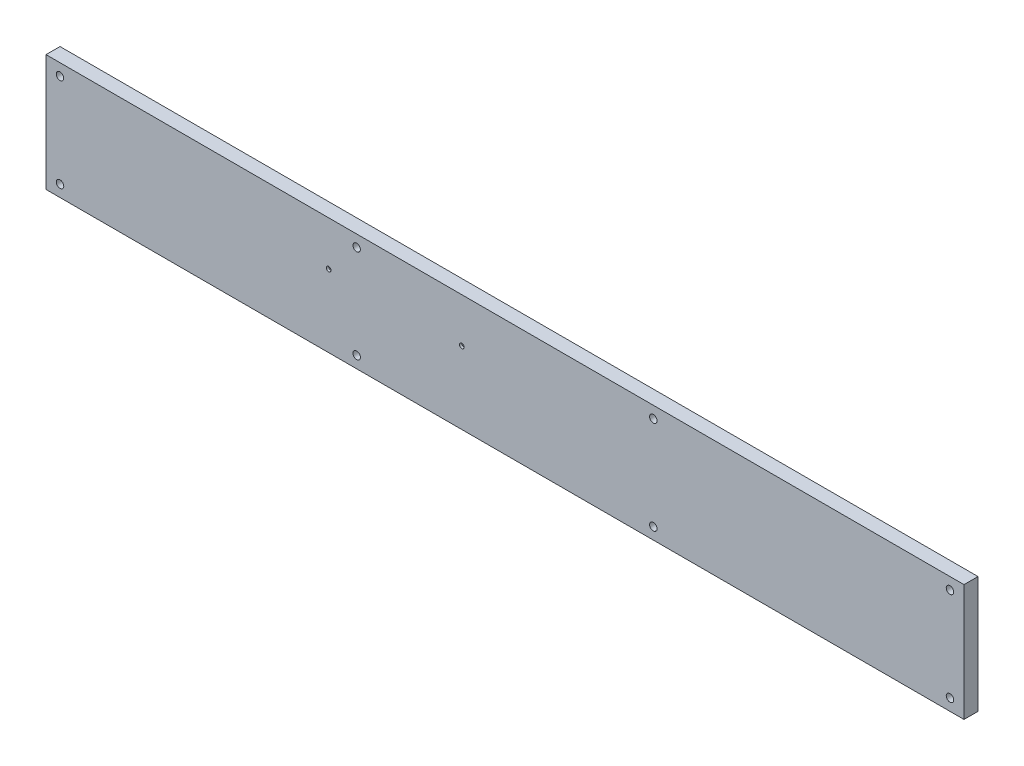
SolidWorks part; units mm, degrees
ref_plane "Plan de face" through (0, 0, 0) normal (0, 0, 1) x (1, 0, 0)
ref_plane "Plan de dessus" through (0, 0, 0) normal (0, 1, 0) x (1, 0, 0)
ref_plane "Plan de droite" through (0, 0, 0) normal (1, 0, 0) x (0, 0, -1)
sketch "Esquisse1" plane through (0, 0, 0) normal (0, 0, 1) x (1, 0, 0)
  line L0 (-36.65, 25) -> (563.9132, 25) construction
  line L1 (0, 0) -> (393, 0)
  line L2 (0, 0) -> (0, 50)
  line L3 (0, 50) -> (393, 50)
  line L4 (393, 0) -> (393, 50)
  line L5 (196.5, -20.2019) -> (196.5, 67.4854) construction
  line L6 (6, -5.3147) -> (6, 36.6425) construction
  line L7 (6, 5) -> (418.2031, 5) construction
  line L9 (3.8114, 45) -> (14.6991, 45) construction
  line L10 (393, -36.0722) -> (393, 101.1749) construction
  line L12 (303.9608, 0) -> (-25.6507, 0) construction
  line L13 (569.7795, 50) -> (-25.6507, 50) construction
  circle A0 centre (6, 5) radius 1.6
  circle A1 centre (133, 5) radius 1.6
  circle A2 centre (260, 5) radius 1.6
  circle A3 centre (387, 5) radius 1.6
  circle A4 centre (6, 45) radius 1.6
  circle A5 centre (133, 45) radius 1.6
  circle A6 centre (260, 45) radius 1.6
  circle A7 centre (387, 45) radius 1.6
extrude "Extrusion1" add sketch "Esquisse1" along normal blind 6
sketch "Esquisse2" plane through (0, 0, 6) normal (0, 0, 1) x (1, 0, 0)
  line L0 (-5.4829, 31) -> (122.7786, 31) construction
  line L1 (121, 14.3361) -> (121, 36.6425) construction
  line L2 (178, 14.3361) -> (178, 36.6425) construction
  circle A0 centre (121, 31) radius 1
  circle A1 centre (178, 31) radius 1
extrude "Enlèv. mat.-Extru.1" cut sketch "Esquisse2" against normal blind 1
